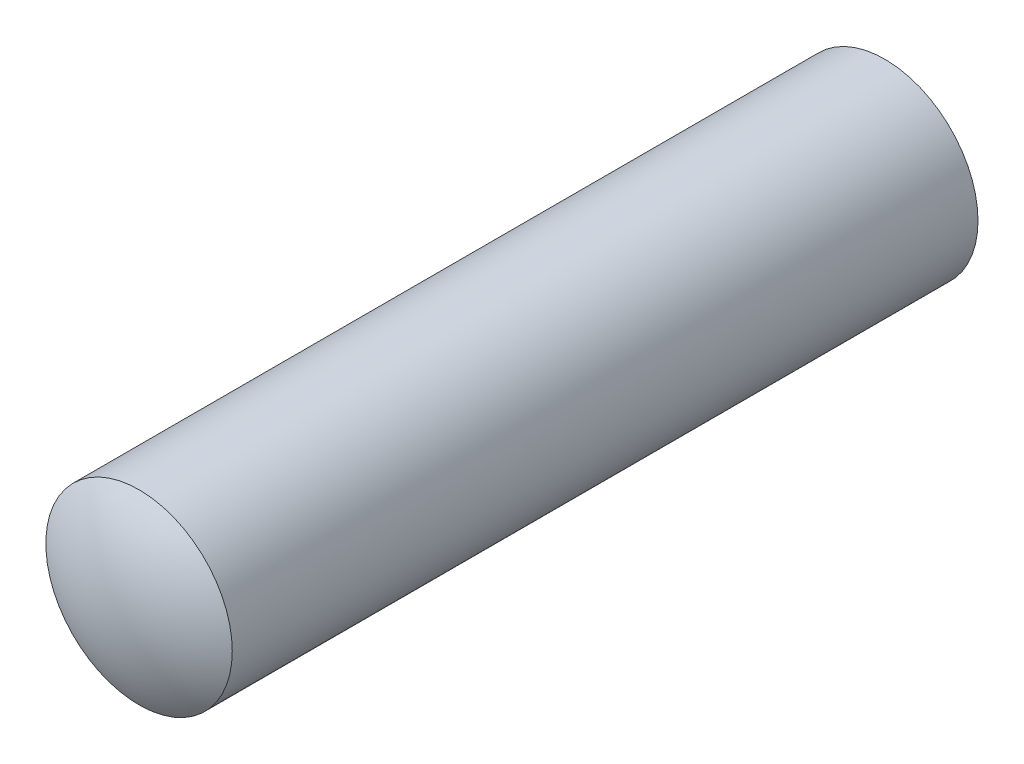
SolidWorks part; units mm, degrees
ref_plane "Plan1" through (0, 0, 0) normal (0, 0, 1) x (1, 0, 0)
ref_plane "Plan2" through (0, 0, 0) normal (0, 1, 0) x (1, 0, 0)
ref_plane "Plan3" through (0, 0, 0) normal (1, 0, 0) x (0, 0, -1)
sketch "Esquisse1" plane through (0, 0, 0) normal (0, 0, 1) x (1, 0, 0)
  circle A0 centre (0, 0) radius 2.5
  dimension "D1" = 5
extrude "Base-Extrusion" add sketch "Esquisse1" along normal mid plane 20
dome "Dôme1" faces to dome 1 distance 0.75 parameters "D1"=0.75
dome "Dôme2" faces to dome 1 distance 0.75 parameters "D1"=0.75
